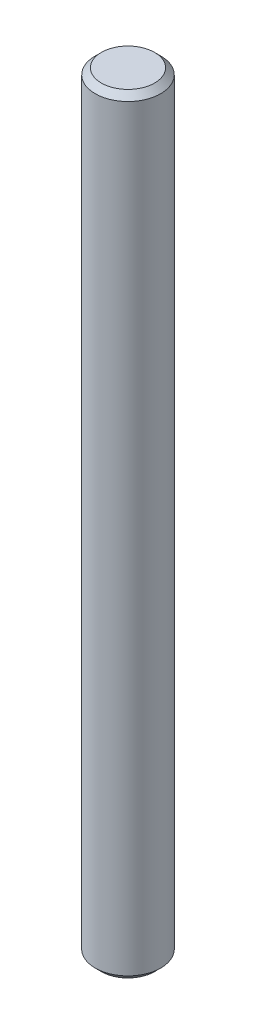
SolidWorks part; units mm, degrees
ref_plane "Front" through (0, 0, 0) normal (0, 0, 1) x (1, 0, 0)
ref_plane "Top" through (0, 0, 0) normal (0, 1, 0) x (1, 0, 0)
ref_plane "Right" through (0, 0, 0) normal (1, 0, 0) x (0, 0, -1)
sketch "Sketch1" plane through (0, 0, 0) normal (0, 1, 0) x (1, 0, 0)
  circle A0 centre (0, 0) radius 4
extrude "Extrude1" add sketch "Sketch1" along normal blind 94
chamfer "Chamfer1" distance 0.75 angle 45 2 edges at (0, 94, 4) (0, 0, 4)
